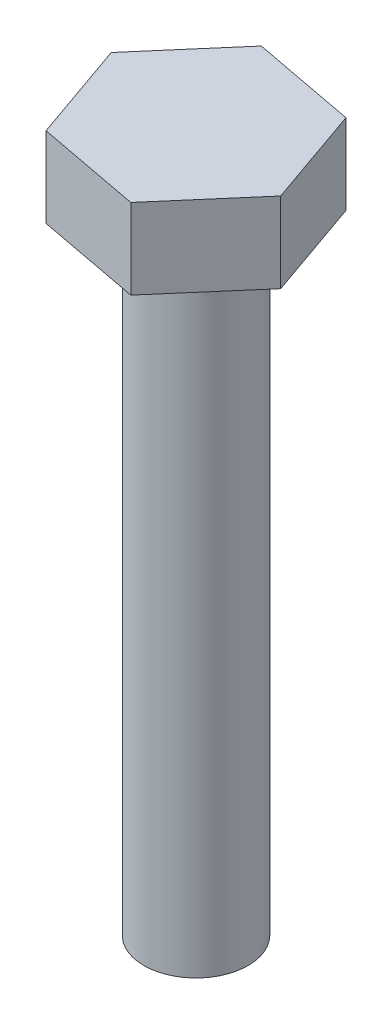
SolidWorks part; units mm, degrees
ref_plane "Front Plane" through (0, 0, 0) normal (0, 0, 1) x (1, 0, 0)
ref_plane "Top Plane" through (0, 0, 0) normal (0, 1, 0) x (1, 0, 0)
ref_plane "Right Plane" through (0, 0, 0) normal (1, 0, 0) x (0, 0, -1)
sketch "Sketch1" plane through (0, 39.37, 0) normal (0, 1, 0) x (1, 0, 0)
  line L1 (-37.0929, -105.7301) -> (-39.3151, -99.3801)
  line L2 (-39.3151, -99.3801) -> (-45.9254, -98.1295)
  line L3 (-45.9254, -98.1295) -> (-50.3136, -103.229)
  line L4 (-50.3136, -103.229) -> (-48.0914, -109.579)
  line L5 (-48.0914, -109.579) -> (-41.4811, -110.8295)
  line L6 (-41.4811, -110.8295) -> (-37.0929, -105.7301)
  circle A0 centre (-43.7032, -104.4795) radius 5.8263 construction
  dimension "D1" = 6.35
extrude "Boss-Extrude1" add sketch "Sketch1" along normal blind 5.08
sketch "Sketch2" plane through (0, 39.37, 0) normal (0, -1, 0) x (1, 0, 0)
  circle A1 centre (-43.7032, 104.4795) radius 3.3
  circle A2 centre (-43.7032, 104.4795) radius 3.3 construction
extrude "Boss-Extrude2" add sketch "Sketch2" along normal up to surface (39.37 mm away)
